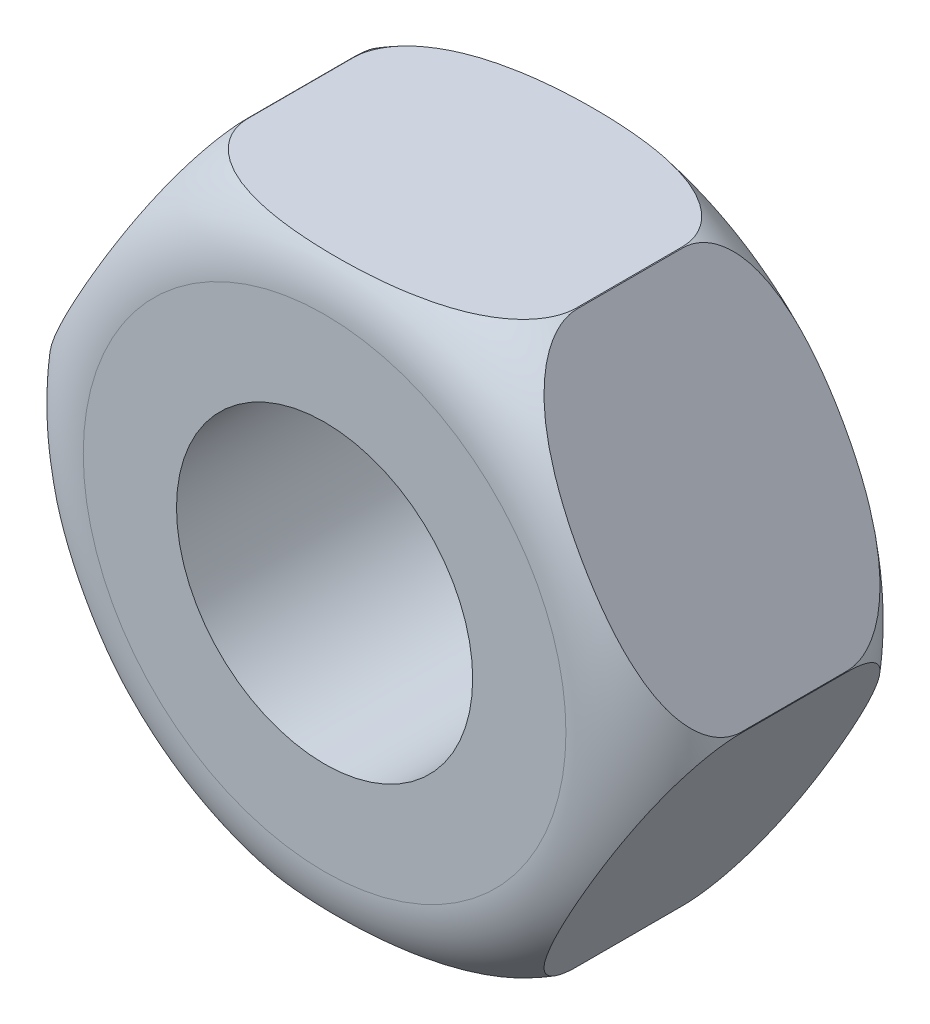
SolidWorks part; units mm, degrees
ref_plane "Plan1" through (0, 0, 0) normal (0, 0, 1) x (1, 0, 0)
ref_plane "Plan2" through (0, 0, 0) normal (0, 1, 0) x (1, 0, 0)
ref_plane "Plan3" through (0, 0, 0) normal (1, 0, 0) x (0, 0, -1)
sketch "Esquisse1" plane through (0, 0, 0) normal (0, 0, 1) x (1, 0, 0)
  circle A0 centre (0, 0) radius 7.5
  dimension "D1" = 15
extrude "Extrusion1" add sketch "Esquisse1" along normal blind 6.4
fillet "Congé1" radius 2
sketch "Esquisse2" plane through (0, 0, 6.4) normal (0, 0, 1) x (1, 0, 0)
  line L1 (7.5056, 0) -> (3.7528, 6.5)
  line L2 (3.7528, 6.5) -> (-3.7528, 6.5)
  line L3 (-3.7528, 6.5) -> (-7.5056, 0)
  line L4 (-7.5056, 0) -> (-3.7528, -6.5)
  line L5 (-3.7528, -6.5) -> (3.7528, -6.5)
  line L6 (3.7528, -6.5) -> (7.5056, 0)
  circle A0 centre (0, 0) radius 6.5 construction
  circle A1 centre (0, 0) radius 14.1421
  dimension "D1" = 13
extrude "Enlèv. mat.-Extru.1" cut sketch "Esquisse2" against normal through all
sketch "Esquisse3" plane through (0, 0, 6.4) normal (0, 0, 1) x (1, 0, 0)
  circle A0 centre (0, 0) radius 3.375
  circle A1 centre (0, 0) radius 7.5 construction
  dimension "D1" = 6.75
extrude "Enlèv. mat.-Extru.2" cut sketch "Esquisse3" against normal through all
